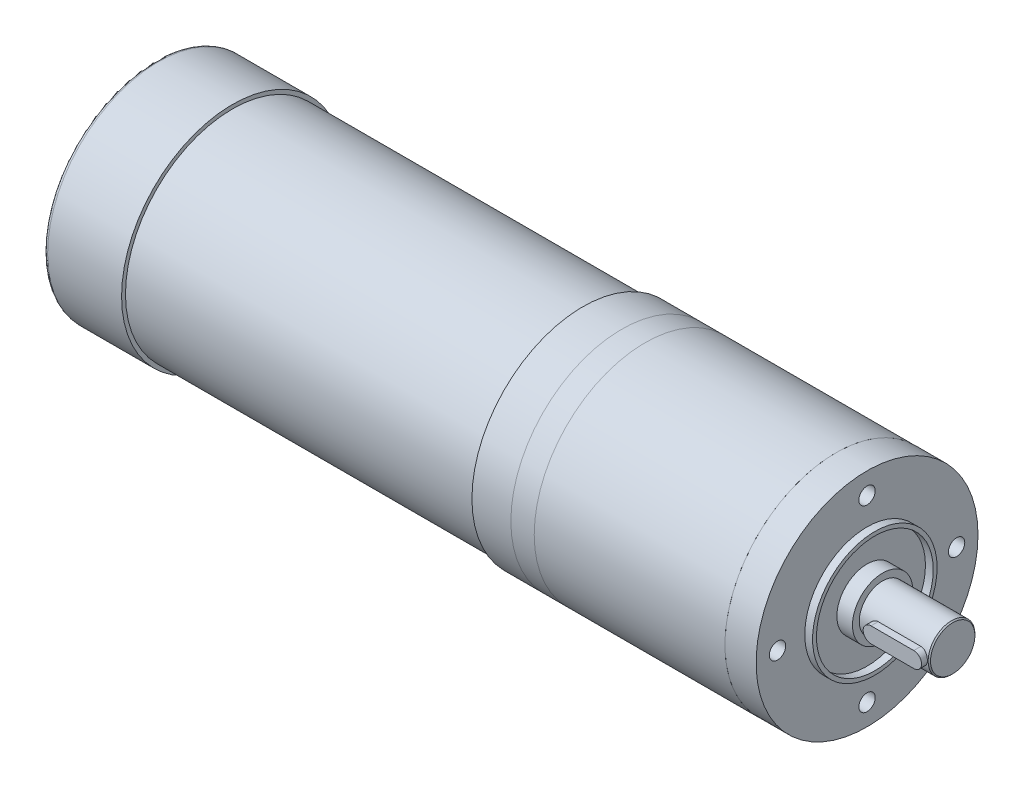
SolidWorks part; units mm, degrees
ref_plane "前视基准面" through (0, 0, 0) normal (0, 0, 1) x (1, 0, 0)
ref_plane "上视基准面" through (0, 0, 0) normal (0, 1, 0) x (1, 0, 0)
ref_plane "右视基准面" through (0, 0, 0) normal (1, 0, 0) x (0, 0, -1)
sketch "草图1" plane through (0, 0, 0) normal (1, 0, 0) x (0, 0, -1)
  circle A0 centre (0, 0) radius 28.5
extrude "凸台-拉伸1" add sketch "草图1" against normal blind 8
sketch "草图2" plane through (-8, 0, 0) normal (-1, 0, 0) x (0, 0, 1)
  circle A0 centre (0, 0) radius 28.5
extrude "凸台-拉伸2" add sketch "草图2" along normal blind 49 separate body
sketch "草图3" plane through (-57, 0, 0) normal (-1, 0, 0) x (0, 0, 1)
  circle A0 centre (0, 0) radius 28.5
extrude "凸台-拉伸3" add sketch "草图3" along normal blind 6 separate body
sketch "草图4" plane through (-63, 0, 0) normal (-1, 0, 0) x (0, 0, 1)
  circle A0 centre (0, 0) radius 28.5
extrude "凸台-拉伸4" add sketch "草图4" along normal blind 10 separate body
sketch "草图5" plane through (-73, 0, 0) normal (-1, 0, 0) x (0, 0, 1)
  circle A0 centre (0, 0) radius 27.5
extrude "凸台-拉伸5" add sketch "草图5" along normal blind 90
sketch "草图6" plane through (-163, 0, 0) normal (-1, 0, 0) x (0, 0, 1)
  circle A0 centre (0, 0) radius 28.5
extrude "凸台-拉伸6" add sketch "草图6" along normal blind 20
fillet "圆角1" radius 1 1 edges at (-183, 0, 28.5)
sketch "草图7" plane through (0, 0, 0) normal (1, 0, 0) x (0, 0, -1)
  circle A0 centre (0, 0) radius 16
  circle A1 centre (0, 0) radius 15
extrude "凸台-拉伸7" add sketch "草图7" along normal blind 2
sketch "草图8" plane through (0, 0, 0) normal (1, 0, 0) x (0, 0, -1)
  circle A0 centre (0, 0) radius 7.75
extrude "凸台-拉伸8" add sketch "草图8" along normal blind 4
sketch "草图9" plane through (4, 0, 0) normal (1, 0, 0) x (0, 0, -1)
  circle A0 centre (0, 0) radius 6
extrude "凸台-拉伸9" add sketch "草图9" along normal blind 18
sketch "草图10" plane through (0, 0, 0) normal (1, 0, 0) x (0, 0, -1)
  point P3 (0, 23)
  point P4 (23, 0)
  point P5 (0, -23)
  point P6 (-23, 0)
hole_wizard "M5 螺纹孔1" positions "3D草图1" profile "草图11" tap size "M5" standard "GB"
sketch3d "3D草图1"
  point P0 (0, 23, 0)
  point P3 (0, 0, -23)
  point P6 (0, -23, 0)
  point P9 (0, 0, 23)
sketch "草图11" plane through (0, 23, 0) normal (0, 1, 0) x (0, 0, -1)
  line L0 (0, 0) -> (0, 15.2618)
  line L1 (0, 15.2618) -> (2.1, 14)
  line L2 (2.1, 14) -> (2.1, 0)
  line L5 (2.1, 0) -> (0, 0)
  line L10 (0, 15.2618) -> (-2.1, 14) construction
  line L11 (0, -6.35) -> (0, 107.95) construction
  dimension "螺纹孔钻头直径" = 4.2
  dimension "螺纹孔钻头深度" = 14
  dimension "导头角度" = 118
ref_plane "基准面1" through (0, 0, 6) normal (0, 0, 1) x (1, 0, 0)
sketch "草图12" plane through (0, 0, 6) normal (0, 0, 1) x (1, 0, 0)
  line L3 (8.5, 2) -> (19.5, 2)
  line L5 (19.5, -2) -> (8.5, -2)
  arc A0 (19.5, -2) -> (19.5, 2) centre (19.5, 0) ccw
  arc A1 (8.5, 2) -> (8.5, -2) centre (8.5, 0) ccw
extrude "切除-拉伸1" cut sketch "草图12" against normal blind 2.5
sketch "草图13" plane through (0, 0, 3.5) normal (0, 0, 1) x (1, 0, 0)
  line L0 (8.5, 2) -> (19.5, 2)
  line L2 (19.5, -2) -> (8.5, -2)
  arc A0 (8.5, 2) -> (8.5, -2) centre (8.5, 0) ccw
  arc A1 (19.5, -2) -> (19.5, 2) centre (19.5, 0) ccw
extrude "凸台-拉伸10" add sketch "草图13" along normal blind 4 separate body
chamfer "倒角1" distance 0.3 angle 45 1 edges at (22, 0, -6)
